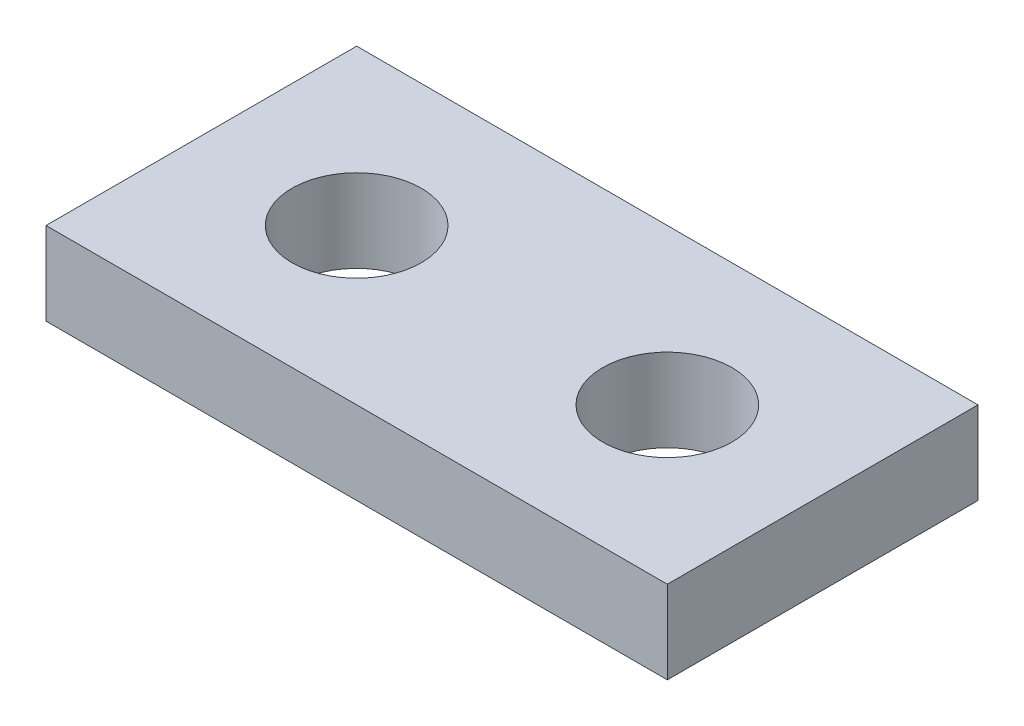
SolidWorks part; units mm, degrees
ref_plane "Front Plane" through (0, 0, 0) normal (0, 0, 1) x (1, 0, 0)
ref_plane "Top Plane" through (0, 0, 0) normal (0, 1, 0) x (1, 0, 0)
ref_plane "Right Plane" through (0, 0, 0) normal (1, 0, 0) x (0, 0, -1)
sketch "Sketch1" plane through (0, 0, 0) normal (0, 1, 0) x (1, 0, 0)
  line L0 (0, 0) -> (0, 14.9391) construction
  line L1 (-9.525, -4.7625) -> (9.525, -4.7625)
  line L2 (-9.525, -4.7625) -> (-9.525, 4.7625)
  line L3 (-9.525, 4.7625) -> (9.525, 4.7625)
  line L4 (9.525, -4.7625) -> (9.525, 4.7625)
  line L5 (-9.525, -4.7625) -> (9.525, 4.7625) construction
  line L6 (-9.525, 4.7625) -> (9.525, -4.7625) construction
  line L7 (0, 0) -> (-34.5199, 0) construction
  circle A0 centre (-4.7625, 0) radius 1.9812
  circle A1 centre (4.7625, 0) radius 1.9812
  point P0 (0, 0)
  dimension "D3" = 3.9624
  dimension "D4" = 9.525
  dimension "D1" = 9.525
  dimension "D2" = 19.05
extrude "Boss-Extrude1" add sketch "Sketch1" along normal blind 2.54
